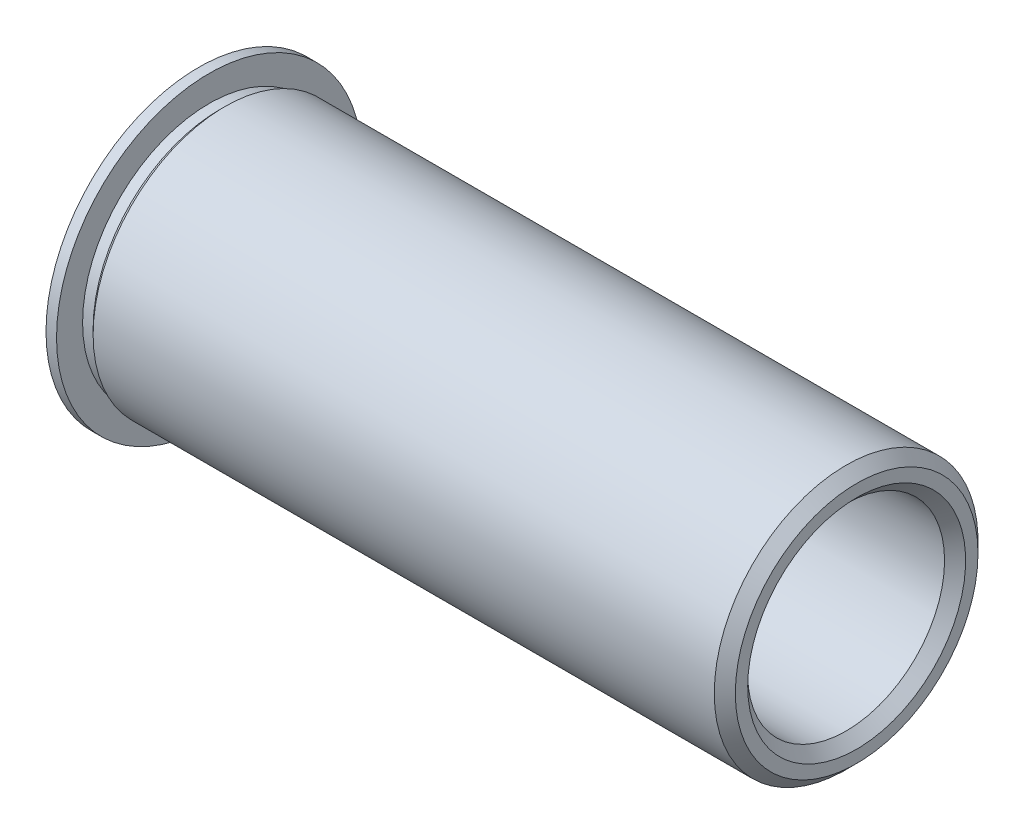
SolidWorks part; units mm, degrees
ref_plane "Front Plane" through (0, 0, 0) normal (0, 0, 1) x (1, 0, 0)
ref_plane "Top Plane" through (0, 0, 0) normal (0, 1, 0) x (1, 0, 0)
ref_plane "Right Plane" through (0, 0, 0) normal (1, 0, 0) x (0, 0, -1)
sketch "Sketch2" plane through (0, 0, 0) normal (0, 0, 1) x (1, 0, 0)
  line L0 (-60.9661, 95.4401) -> (-60.9661, 99.1231)
  line L1 (-60.9661, 99.1231) -> (-60.7121, 99.1231)
  line L2 (-60.9661, 95.4401) -> (-45.0911, 95.4401)
  line L3 (-45.0911, 95.4401) -> (-45.0911, 98.3674)
  line L4 (-45.0911, 98.3674) -> (-45.3451, 98.6214)
  line L5 (-45.3451, 98.6214) -> (-60.3311, 98.6214)
  line L6 (-60.3311, 98.6214) -> (-60.4581, 98.4944)
  line L7 (-60.4581, 98.4944) -> (-60.7121, 98.4944)
  line L8 (-60.7121, 98.4944) -> (-60.7121, 99.1231)
  dimension "D1" = 3.683
  dimension "D2" = 0.254
  dimension "D3" = 3.1813
  dimension "D4" = 0.254
  dimension "D5" = 0.254
  dimension "D6" = 15.875
  dimension "D7" = 0.127
  dimension "D8" = 0.254
revolve "Revolve3" add sketch "Sketch2" angle 360 about L2
sketch "Sketch3" plane through (-45.0911, 0, 0) normal (1, 0, 0) x (0, 0, -1)
  circle A0 centre (0, 95.4401) radius 2.3749
  dimension "D1" = 4.7498
extrude "Cut-Extrude1" cut sketch "Sketch3" against normal through all
chamfer "Chamfer2" distance 0.254 angle 45 1 edges at (-60.9661, 95.4401, -2.3749)
chamfer "Chamfer3" distance 0.254 angle 45 1 edges at (-45.0911, 95.4401, -2.3749)
